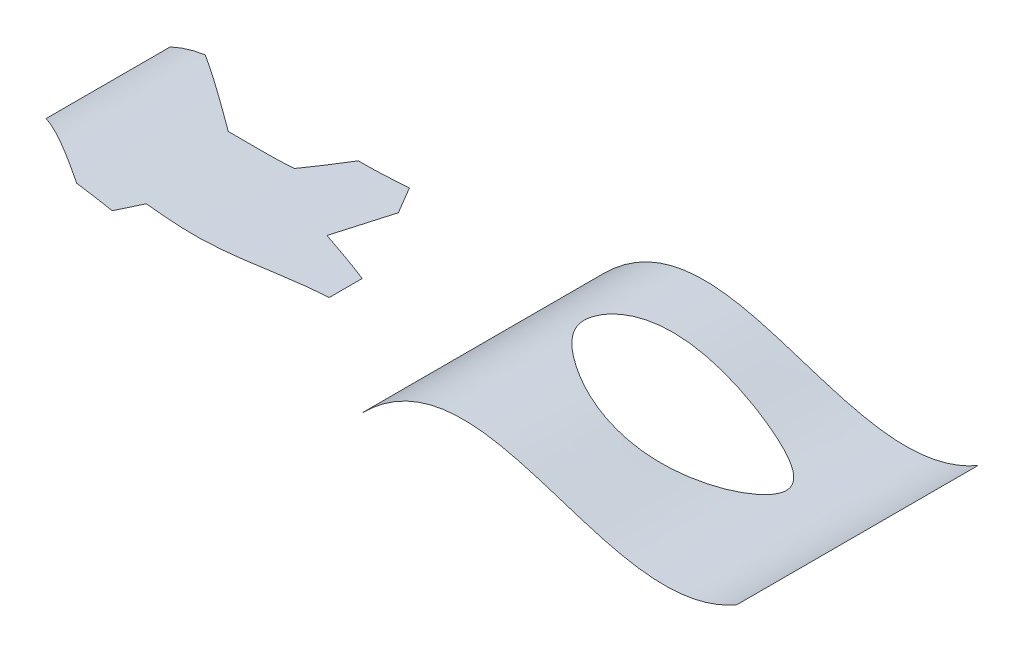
SolidWorks part; units mm, degrees
ref_plane "Front Plane" through (0, 0, 0) normal (0, 0, 1) x (1, 0, 0)
ref_plane "Top Plane" through (0, 0, 0) normal (0, 1, 0) x (1, 0, 0)
ref_plane "Right Plane" through (0, 0, 0) normal (1, 0, 0) x (0, 0, -1)
sketch "Sketch1" plane through (0, 0, 0) normal (0, 0, 1) x (1, 0, 0)
  spline S0 degree 3 poles (-86.6585, -5.822) (-47.484, 12.6614) (18.173, -18.2839) (87.1006, -5.2918) (116.2948, -5.822) knots 0 0 0 0 0.566891 1 1 1 1
surface "Surface-Extrude1" sketch "Sketch1" parameters "D1"=120
sketch "Sketch2" plane through (0, 0, 0) normal (0, 1, 0) x (1, 0, 0)
  line L0 (-62.6792, 60) -> (-12.4589, 25.5573)
  line L1 (-86.6585, 60) -> (116.2948, 60) construction
  line L2 (-12.4589, 25.5573) -> (25.6319, 32.6559)
  line L3 (25.6319, 32.6559) -> (42.0355, 60)
  line L4 (42.0355, 60) -> (-62.6792, 60)
surface "Surface-Trim1"
sketch "Sketch3" plane through (0, 0, 0) normal (0, 1, 0) x (1, 0, 0)
  line L0 (-86.6585, -24.9655) -> (-30.5981, -60)
  line L1 (-86.6585, -60) -> (-86.6585, 60) construction
  line L2 (116.2948, -60) -> (-86.6585, -60) construction
  line L3 (-30.5981, -60) -> (-86.6585, -60)
  line L4 (-86.6585, -60) -> (-86.6585, -24.9655)
surface "Surface-Trim2"
sketch "Sketch4" plane through (0, 0, 0) normal (0, 1, 0) x (1, 0, 0)
  line L0 (118.6915, -33.9) -> (0, -42.9666)
  line L1 (0, -42.9666) -> (-6.3321, -60)
  line L2 (116.2948, -60) -> (-30.5981, -60) construction
  line L3 (-6.3321, -60) -> (118.6915, -60)
  line L4 (118.6915, -60) -> (118.6915, -33.9)
surface "Surface-Trim3"
sketch "Sketch5" plane through (0, 0, 0) normal (0, 1, 0) x (1, 0, 0)
  line L0 (116.2948, -11.5658) -> (77.0804, 3.5723)
  line L1 (116.2948, 60) -> (116.2948, -34.0831) construction
  line L2 (77.0804, 3.5723) -> (88.8399, 40.6757)
  line L3 (88.8399, 40.6757) -> (77.0804, 60)
  line L4 (42.0355, 60) -> (116.2948, 60) construction
  line L5 (77.0804, 60) -> (116.2948, 60)
  line L6 (116.2948, 60) -> (116.2948, -11.5658)
surface "Surface-Trim4"
sketch "Sketch6" plane through (0, 0, 0) normal (0, 0, 1) x (1, 0, 0)
  spline S0 degree 3 poles (187.2084, -14.5076) (271.1044, 69.695) (354.7018, -51.5241) (443.6544, 0) knots 0 0 0 0 1 1 1 1
surface "Surface-Extrude2" sketch "Sketch6" parameters "D1"=165
sketch "Sketch7" plane through (0, 0, 0) normal (0, 1, 0) x (1, 0, 0)
  spline S0 degree 3 poles (283.0224, -33.0228) (207.5307, 34.2795) (315.7807, 54.972) (398.3818, 20.2918) (339.172, -29.1058) (283.0224, -33.0228) (207.5307, 34.2795) (315.7807, 54.972) knots -0.522501 -0.407154 -0.150331 0 0.296092 0.477499 0.592846 0.849669 1 1.296092 1.477499 1.592846 only from (237.3406, 17.1535) to (237.3406, 17.1535)
surface "Surface-Trim5"
